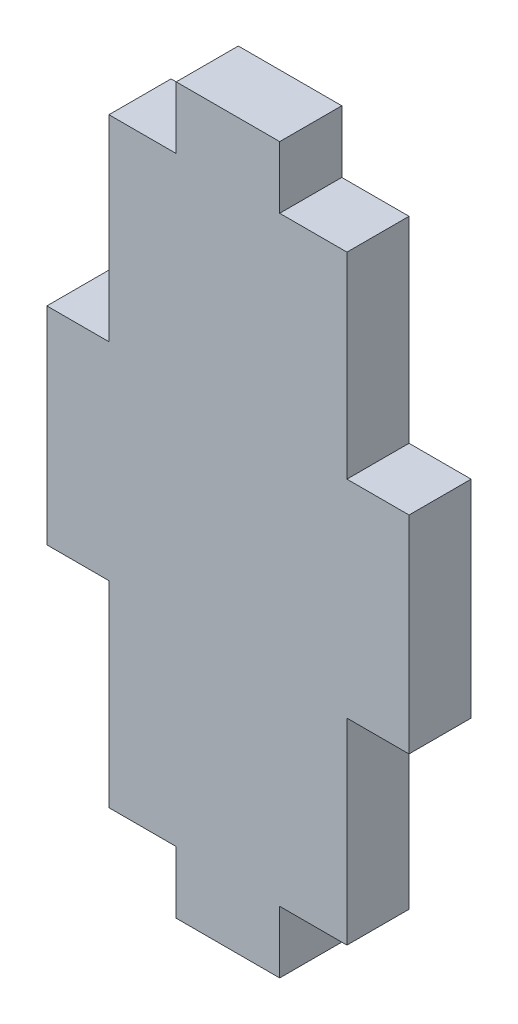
SolidWorks part; units mm, degrees
ref_plane "Alzado" through (0, 0, 0) normal (0, 0, 1) x (1, 0, 0)
ref_plane "Planta" through (0, 0, 0) normal (0, 1, 0) x (1, 0, 0)
ref_plane "Vista lateral" through (0, 0, 0) normal (1, 0, 0) x (0, 0, -1)
sketch "Croquis1" plane through (0, 0, 0) normal (0, 0, 1) x (1, 0, 0)
  line L1 (45.1577, 36.4022) -> (62.6577, 36.4022)
  line L2 (45.1577, 36.4022) -> (45.1577, 71.4022)
  line L3 (45.1577, 71.4022) -> (62.6577, 71.4022)
  line L4 (62.6577, 36.4022) -> (62.6577, 71.4022)
  line L5 (62.6577, 36.4022) -> (45.1577, 71.4022) construction
  line L6 (45.1577, 36.4022) -> (62.6577, 71.4022) construction
  line L7 (56.4077, 71.4022) -> (59.6577, 71.4022) construction
  point P0 (0, 0)
extrude "Saliente-Extruir1" add sketch "Croquis1" along normal blind 3
extrude "Cortar-Extruir4" cut sketch "Croquis5" against normal through all both and the other way through all
sketch "Croquis5" plane through (162.6577, 79.842, 0) normal (0, 0, -1) x (1, 0, 0)
  line L16 (-106.25, 8.4398) -> (-103, 8.4398)
  line L18 (-103, 11.4398) -> (-106.25, 11.4398)
  line L19 (-106.25, 11.4398) -> (-106.25, 8.4398)
  line L20 (-100, 20.9398) -> (-103, 20.9398)
  line L21 (-103, 20.9398) -> (-103, 11.4398)
  line L22 (-103, 8.4398) -> (-100, 8.4398)
  line L23 (-100, 8.4398) -> (-100, 20.9398)
  line L24 (-114.5, 20.9398) -> (-117.5, 20.9398)
  line L25 (-117.5, 20.9398) -> (-117.5, 8.4398)
  line L26 (-117.5, 8.4398) -> (-114.5, 8.4398)
  line L27 (-114.5, 11.4398) -> (-114.5, 20.9398)
  line L28 (-111.25, 11.4398) -> (-114.5, 11.4398)
  line L30 (-114.5, 8.4398) -> (-111.25, 8.4398)
  line L31 (-111.25, 8.4398) -> (-111.25, 11.4398)
  line L32 (-100, 25.9398) -> (-117.5, 25.9398) construction
  line L35 (-111.25, 43.4398) -> (-111.25, 40.4398)
  line L36 (-114.5, 43.4398) -> (-111.25, 43.4398)
  line L37 (-111.25, 40.4398) -> (-114.5, 40.4398)
  line L38 (-114.5, 40.4398) -> (-114.5, 30.9398)
  line L39 (-117.5, 43.4398) -> (-114.5, 43.4398)
  line L40 (-117.5, 30.9398) -> (-117.5, 43.4398)
  line L41 (-114.5, 30.9398) -> (-117.5, 30.9398)
  line L42 (-100, 43.4398) -> (-100, 30.9398)
  line L43 (-103, 43.4398) -> (-100, 43.4398)
  line L44 (-103, 30.9398) -> (-103, 40.4398)
  line L45 (-100, 30.9398) -> (-103, 30.9398)
  line L46 (-106.25, 40.4398) -> (-106.25, 43.4398)
  line L47 (-103, 40.4398) -> (-106.25, 40.4398)
  line L48 (-106.25, 43.4398) -> (-103, 43.4398)
equation "\"grosor\"= 3"
